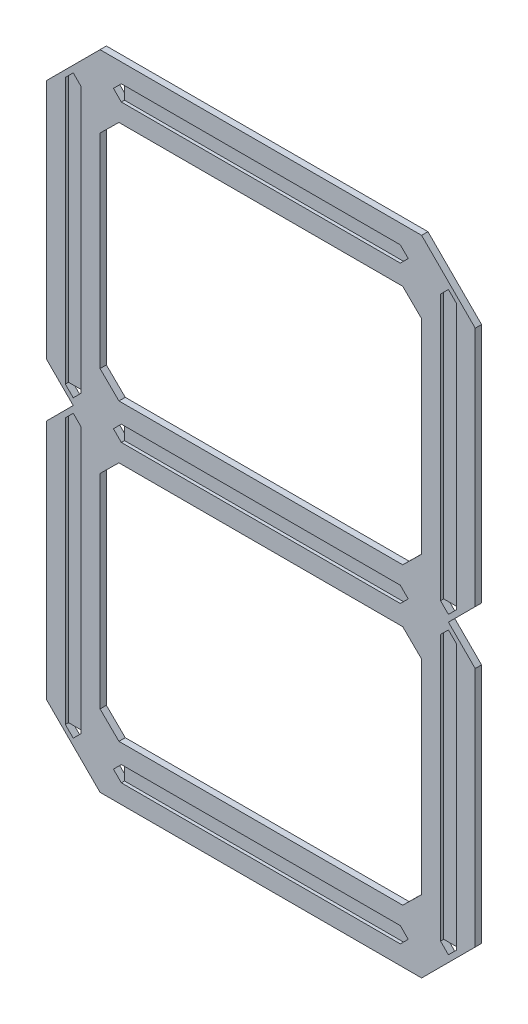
SolidWorks part; units mm, degrees
ref_plane "Front Plane" through (0, 0, 0) normal (0, 0, 1) x (1, 0, 0)
ref_plane "Top Plane" through (0, 0, 0) normal (0, 1, 0) x (1, 0, 0)
ref_plane "Right Plane" through (0, 0, 0) normal (1, 0, 0) x (0, 0, -1)
sketch "Sketch1" plane through (0, 0, 0) normal (0, 0, 1) x (1, 0, 0)
  line L0 (-203.2, 25.4) -> (-203.2, 254)
  line L1 (152.4, 304.8) -> (203.2, 254)
  line L2 (-203.2, -25.4) -> (-203.2, -254)
  line L3 (-152.4, -304.8) -> (152.4, -304.8)
  line L4 (203.2, -254) -> (203.2, -25.4)
  line L5 (177.8, 0) -> (203.2, -25.4)
  line L6 (177.8, 0) -> (203.2, 25.4)
  line L7 (203.2, 25.4) -> (203.2, 254)
  line L8 (-177.8, 279.4) -> (-152.4, 254) construction
  line L9 (152.4, -304.8) -> (203.2, -254)
  line L10 (-152.4, -304.8) -> (-203.2, -254)
  line L11 (152.4, 304.8) -> (-152.4, 304.8)
  line L12 (-152.4, 43.041) -> (-152.4, 236.359)
  line L13 (-134.493, 254) -> (134.493, 254)
  line L14 (-177.8, 0) -> (-203.2, 25.4)
  line L15 (-177.8, 0) -> (-203.2, -25.4)
  line L16 (-177.8, 0) -> (-136.6185, 0) construction
  line L17 (-152.4, -236.359) -> (-152.4, -43.041)
  line L18 (-134.493, -25.4) -> (134.493, -25.4)
  line L19 (-152.4, 304.8) -> (-203.2, 254)
  line L20 (152.4, -43.041) -> (152.4, -236.359)
  line L21 (177.8, 279.4) -> (152.4, 254) construction
  line L22 (134.493, -254) -> (-134.493, -254)
  line L23 (-152.4, 279.4) -> (-134.493, 279.4) construction
  line L24 (-177.8, 254.266) -> (-177.8, 236.359) construction
  line L25 (-152.4, 236.359) -> (-134.493, 254)
  line L26 (152.4, 43.041) -> (134.493, 25.4)
  line L27 (152.4, 236.359) -> (134.493, 254)
  line L28 (-152.4, 139.7) -> (-99.5179, 139.7) construction
  line L29 (-152.4, 43.041) -> (-134.493, 25.4)
  line L30 (-152.4, -43.041) -> (-134.493, -25.4)
  line L31 (-177.8, 0) -> (-152.4, 25.4) construction
  line L32 (152.4, 236.359) -> (152.4, 43.041)
  line L33 (177.8, 0) -> (152.4, 25.4) construction
  line L34 (134.493, 25.4) -> (-134.493, 25.4)
  line L35 (152.4, -43.041) -> (134.493, -25.4)
  line L36 (152.4, -236.359) -> (134.493, -254)
  line L37 (-152.4, -236.359) -> (-134.493, -254)
  point P22 (-141.879, 243.479)
  dimension "D1" = 17.907
  dimension "D2" = 17.907
extrude "Boss-Extrude1" add sketch "Sketch1" against normal blind 6
sketch "Sketch2" plane through (0, 0, 0) normal (0, 0, 1) x (1, 0, 0)
  line L0 (-185.3, 13.85) -> (-185.3, 265.55)
  line L3 (-139.7, 279.4) -> (-132.2, 286.9)
  line L4 (-132.2, 286.9) -> (132.2, 286.9)
  line L5 (132.2, 271.9) -> (-132.2, 271.9)
  line L8 (-177.8, 273.05) -> (-185.3, 265.55)
  line L9 (-170.3, 265.55) -> (-170.3, 13.85)
  line L10 (-139.7, 279.4) -> (-132.2, 271.9)
  line L11 (139.7, 279.4) -> (132.2, 286.9)
  line L12 (139.7, 279.4) -> (132.2, 271.9)
  line L13 (185.3, -13.85) -> (185.3, -265.55)
  line L16 (177.8, -273.05) -> (185.3, -265.55)
  line L17 (177.8, 6.35) -> (170.3, 13.85)
  line L18 (-177.8, 273.05) -> (-170.3, 265.55)
  line L19 (-177.8, 6.35) -> (-185.3, 13.85)
  line L20 (-177.8, 6.35) -> (-170.3, 13.85)
  line L21 (177.8, 6.35) -> (185.3, 13.85)
  line L22 (177.8, 273.05) -> (170.3, 265.55)
  line L23 (170.3, 265.55) -> (170.3, 13.85)
  line L24 (177.8, 273.05) -> (185.3, 265.55)
  line L25 (185.3, 13.85) -> (185.3, 265.55)
  line L26 (139.7, 0) -> (132.2, 7.5)
  line L27 (139.7, 0) -> (132.2, -7.5)
  line L28 (-139.7, 0) -> (-132.2, 7.5)
  line L29 (132.2, 7.5) -> (-132.2, 7.5)
  line L30 (-132.2, -7.5) -> (132.2, -7.5)
  line L31 (-139.7, 0) -> (-132.2, -7.5)
  line L32 (170.3, -265.55) -> (170.3, -13.85)
  line L33 (177.8, -273.05) -> (170.3, -265.55)
  line L34 (177.8, -6.35) -> (185.3, -13.85)
  line L35 (-177.8, -6.35) -> (-170.3, -13.85)
  line L36 (-177.8, -6.35) -> (-185.3, -13.85)
  line L37 (-177.8, -273.05) -> (-170.3, -265.55)
  line L38 (177.8, -6.35) -> (170.3, -13.85)
  line L39 (139.7, -279.4) -> (132.2, -271.9)
  line L40 (139.7, -279.4) -> (132.2, -286.9)
  line L41 (-139.7, -279.4) -> (-132.2, -271.9)
  line L42 (-170.3, -265.55) -> (-170.3, -13.85)
  line L43 (-177.8, -273.05) -> (-185.3, -265.55)
  line L44 (132.2, -271.9) -> (-132.2, -271.9)
  line L45 (-132.2, -286.9) -> (132.2, -286.9)
  line L46 (-139.7, -279.4) -> (-132.2, -286.9)
  line L47 (-185.3, -13.85) -> (-185.3, -265.55)
  point P6 (0, 279.4)
  point P7 (-177.8, 139.7)
  point P30 (177.8, 139.7)
  point P37 (0, 0)
  point P50 (177.8, -139.7)
  point P51 (-177.8, -139.7)
  point P52 (0, -279.4)
extrude "Cut-Extrude1" cut sketch "Sketch2" against normal blind 3
sketch "Sketch3" plane through (0, 0, 0) normal (0, 0, 1) x (1, 0, 0)
  line L0 (-185.3, 13.85) -> (-170.3, 13.85)
  line L1 (-170.3, 13.85) -> (-170.3, 265.55) construction
  line L2 (-177.8, 6.35) -> (-170.3, 13.85) construction
  line L3 (-170.3, 13.85) -> (-177.8, 6.35)
  line L4 (-177.8, 6.35) -> (-185.3, 13.85)
  line L5 (-132.2, 7.5) -> (-132.2, -7.5)
  line L6 (-132.2, -7.5) -> (-139.7, 0)
  line L7 (-139.7, 0) -> (-132.2, 7.5)
  line L8 (-185.3, -265.55) -> (-170.3, -265.55)
  line L9 (-170.3, -265.55) -> (-177.8, -273.05)
  line L10 (-177.8, -273.05) -> (-185.3, -265.55)
  line L11 (-132.2, -271.9) -> (-132.2, -286.9)
  line L12 (-132.2, -286.9) -> (-139.7, -279.4)
  line L13 (-139.7, -279.4) -> (-132.2, -271.9)
  line L14 (170.3, -265.55) -> (185.3, -265.55)
  line L15 (185.3, -265.55) -> (177.8, -273.05)
  line L16 (177.8, -273.05) -> (170.3, -265.55)
  line L17 (170.3, 13.85) -> (185.3, 13.85)
  line L18 (185.3, 13.85) -> (177.8, 6.35)
  line L19 (-132.2, 286.9) -> (-132.2, 271.9)
  line L20 (-132.2, 271.9) -> (-139.7, 279.4)
  line L21 (-139.7, 279.4) -> (-132.2, 286.9)
  line L22 (177.8, 6.35) -> (170.3, 13.85)
extrude "Cut-Extrude2" cut sketch "Sketch3" against normal blind 127 and the other way blind 90.678
